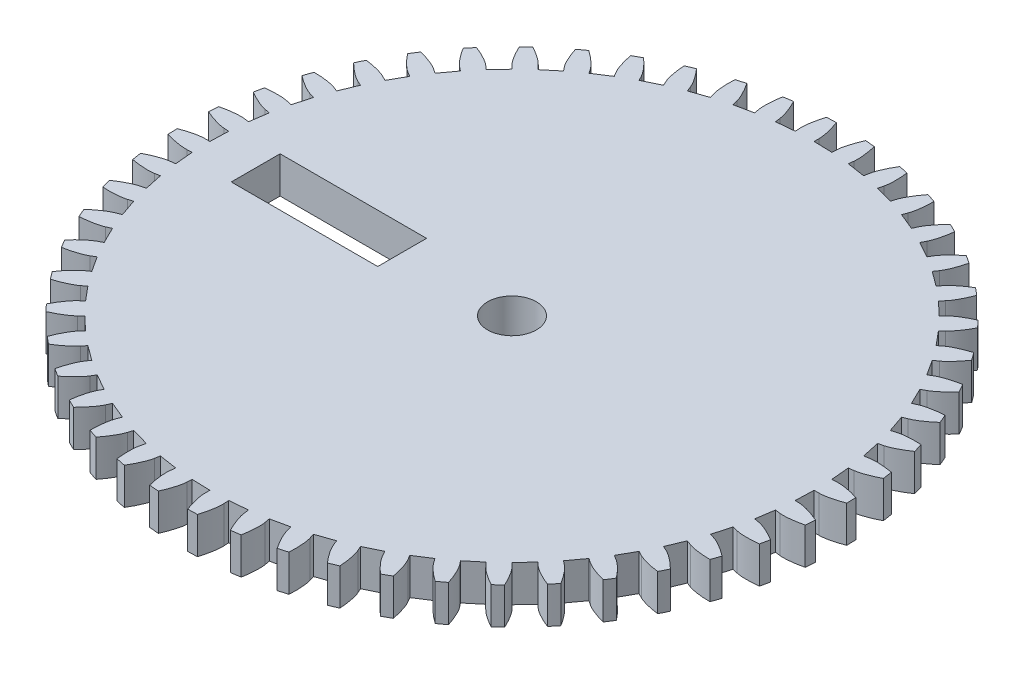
SolidWorks part; units mm, degrees
ref_plane "Front Plane" through (0, 0, 0) normal (0, 0, 1) x (1, 0, 0)
ref_plane "Top Plane" through (0, 0, 0) normal (0, 1, 0) x (1, 0, 0)
ref_plane "Right Plane" through (0, 0, 0) normal (1, 0, 0) x (0, 0, -1)
sketch "Sketch1" plane through (0, 0, 0) normal (0, 1, 0) x (1, 0, 0)
  line L0 (0, 0) -> (0, 12.5859) construction
  line L1 (0, 0) -> (-12.5859, 0) construction
  line L2 (0, 0) -> (-13.4938, -0.4077) construction
  line L3 (0, 0) -> (-12.563, -0.7599) construction
  line L4 (0, 0) -> (-12.4942, -1.5171) construction
  circle A0 centre (0, 0) radius 13 construction
  circle A1 centre (0, 0) radius 12.5859 construction
  circle A2 centre (0, 0) radius 12.375 construction
  circle A3 centre (0, 0) radius 13.5 construction
  spline S0 degree 4 poles (-12.5859, 0) (-12.608, 0) (-12.6699, -0.0023) (-12.7865, -0.0155) (-12.9748, -0.0498) (-13.2113, -0.1118) (-13.5113, -0.2128) (-13.8558, -0.3577) (-14.2233, -0.5437) (-14.6092, -0.7738) (-14.9806, -1.0273) (-15.3371, -1.3013) (-15.679, -1.5934) (-16.0761, -1.9675) (-16.5278, -2.4461) (-17.0173, -3.0416) (-17.5249, -3.7644) (-17.9874, -4.5362) (-18.3967, -5.3369) (-18.7094, -6.0595) (-18.9458, -6.6905) (-19.1221, -7.225) (-19.2509, -7.6538) (-19.3969, -8.2001) (-19.5226, -8.7411) (-19.6295, -9.303) (-19.7338, -9.9536) (-19.8032, -10.5394) (-19.8517, -11.0503) (-19.8907, -11.7697) (-19.9003, -12.1399) (-19.9051, -12.7168) (-19.8947, -12.9798) (-19.8902, -13.2128) (-19.8858, -13.2827) (-19.884, -13.3331) (-19.8831, -13.3603) knots 0 0 0 0 0 0.005377 0.015084 0.028532 0.04661 0.064855 0.092111 0.119476 0.146842 0.174209 0.201575 0.228941 0.256307 0.307035 0.361767 0.4165 0.471232 0.525964 0.580697 0.608063 0.635429 0.662795 0.690161 0.744894 0.77226 0.799626 0.854358 0.881725 0.909091 0.954545 0.977273 0.988636 0.994318 1 1 1 1 1 construction
  spline S1 degree 4 poles (-12.5859, 0) (-12.608, 0) (-12.6699, -0.0023) (-12.7865, -0.0155) (-12.9748, -0.0498) (-13.2113, -0.1118) (-13.5113, -0.2128) (-13.8558, -0.3577) (-14.2233, -0.5437) (-14.6092, -0.7738) (-14.9806, -1.0273) (-15.3371, -1.3013) (-15.679, -1.5934) (-16.0761, -1.9675) (-16.5278, -2.4461) (-17.0173, -3.0416) (-17.5249, -3.7644) (-17.9874, -4.5362) (-18.3967, -5.3369) (-18.7094, -6.0595) (-18.9458, -6.6905) (-19.1221, -7.225) (-19.2509, -7.6538) (-19.3969, -8.2001) (-19.5226, -8.7411) (-19.6295, -9.303) (-19.7338, -9.9536) (-19.8032, -10.5394) (-19.8517, -11.0503) (-19.8792, -11.5586) (-19.8878, -11.764) (-19.8912, -11.8661) knots 0 0 0 0 0 0.005377 0.015084 0.028532 0.04661 0.064855 0.092111 0.119476 0.146842 0.174209 0.201575 0.228941 0.256307 0.307035 0.361767 0.4165 0.471232 0.525964 0.580697 0.608063 0.635429 0.662795 0.690161 0.744894 0.77226 0.799626 0.854358 0.881725 0.909091 0.909091 0.909091 0.909091 0.909091
  dimension "D1" = 27
  dimension "D2" = 26
  dimension "D3" = 25.1718
  dimension "D4" = 24.75
  dimension "D5" = 12.5859
  dimension "D6" = 1.731
  dimension "D7" = 3.462
  dimension "D8" = 6.923
sketch "Sketch2" plane through (0, 0, 0) normal (0, 1, 0) x (1, 0, 0)
  line L0 (0, 0) -> (-13.4938, -0.4077) construction
  line L1 (0, 0) -> (-13.4938, -0.4077) construction
  line L2 (0, 0) -> (-12.563, -0.7599) construction
  line L3 (0, 0) -> (-12.5859, 0) construction
  line L4 (0, 0) -> (-12.4942, -1.5171) construction
  line L5 (0, 0) -> (-12.563, -0.7599) construction
  line L6 (0, 0) -> (-12.5859, 0) construction
  line L7 (0, 0) -> (-12.4942, -1.5171) construction
  line L8 (-12.563, -0.7599) -> (-12.3524, -0.7472)
  line L9 (-12.3524, -0.7472) -> (-12.2848, -1.4916)
  line L10 (-12.2848, -1.4916) -> (-12.4942, -1.5171) construction
  line L11 (-12.2848, -1.4916) -> (-0.9927, -0.1205)
  line L12 (-12.5859, 0) -> (-1, 0)
  circle A0 centre (0, 0) radius 12.375 construction
  circle A1 centre (0, 0) radius 12.5859 construction
  circle A2 centre (0, 0) radius 13 construction
  circle A3 centre (0, 0) radius 13.5 construction
  circle A4 centre (0, 0) radius 12.375 construction
  circle A5 centre (0, 0) radius 12.5859 construction
  circle A6 centre (0, 0) radius 13 construction
  circle A7 centre (0, 0) radius 13.5 construction
  arc A8 (-13.4866, -0.6019) -> (-13.4983, -0.2134) centre (0, 0) cw
  circle A11 centre (0, 0) radius 1 construction
  arc A12 (-1, 0) -> (-0.9927, -0.1205) centre (0, 0) ccw
  spline S0 degree 4 poles (-72.7187, -1998.9187) (-8.9087, -40.06) (-9.6085, -0.848) (-11.3659, 0.243) (-12.9748, -0.0498) (-13.2113, -0.1118) (-13.5113, -0.2128) (-13.8558, -0.3577) (-14.2233, -0.5437) (-14.6092, -0.7738) (-14.9806, -1.0273) (-15.3371, -1.3013) (-15.679, -1.5934) (-16.0761, -1.9675) (-16.5278, -2.4461) (-17.0173, -3.0416) (-17.5249, -3.7644) (-17.9874, -4.5362) (-18.3967, -5.3369) (-18.7094, -6.0595) (-18.9458, -6.6905) (-19.1221, -7.225) (-19.2509, -7.6538) (-19.3969, -8.2001) (-19.5226, -8.7411) (-19.6295, -9.303) (-19.7338, -9.9536) (-19.8032, -10.5394) (-20.0169, -12.7929) (-19.9107, -17.7061) (-17.4908, 39.3606) (-84.8048, -2010.7242) knots -0.351473 -0.351473 -0.351473 -0.351473 -0.351473 0.005377 0.015084 0.028532 0.04661 0.064855 0.092111 0.119476 0.146842 0.174209 0.201575 0.228941 0.256307 0.307035 0.361767 0.4165 0.471232 0.525964 0.580697 0.608063 0.635429 0.662795 0.690161 0.744894 0.77226 0.799626 0.854358 0.881725 1.375858 1.375858 1.375858 1.375858 1.375858 only from (-12.5859, 0) to (-19.8912, -11.8661) construction
  spline S1 degree 4 poles (-12.5859, 0) (-12.608, 0) (-12.6699, -0.0023) (-12.7865, -0.0155) (-12.9748, -0.0498) (-13.1813, -0.104) (-13.3462, -0.1576) (-13.4572, -0.1979) (-13.4983, -0.2134) knots 0 0 0 0 0 0.005377 0.015084 0.028532 0.04661 0.057303 0.057303 0.057303 0.057303 0.057303
  spline S2 degree 4 poles (-12.563, -0.7599) (-12.585, -0.7613) (-12.6469, -0.7627) (-12.7641, -0.7565) (-12.9542, -0.7337) (-13.1635, -0.6921) (-13.3314, -0.6485) (-13.4446, -0.615) (-13.4866, -0.6019) knots 0 0 0 0 0 0.005377 0.015084 0.028532 0.04661 0.057303 0.057303 0.057303 0.057303 0.057303
  point P21 (-12.3524, -0.7472)
  point P24 (-12.2848, -1.4916)
  dimension "D2" = 2
extrude "Boss-Extrude1" add sketch "Sketch2" along normal blind 1.5
pattern_circular "CirPattern1" count 52 over 360 of "Boss-Extrude1"
sketch "Sketch3" plane through (0, 1.5, 0) normal (0, 1, 0) x (1, 0, 0)
  line L1 (-10.5, -1) -> (-4.5, -1)
  line L2 (-10.5, -1) -> (-10.5, 1)
  line L3 (-10.5, 1) -> (-4.5, 1)
  line L4 (-4.5, -1) -> (-4.5, 1)
  line L5 (-10.5, -1) -> (-4.5, 1) construction
  line L6 (-10.5, 1) -> (-4.5, -1) construction
  point P0 (-7.5, 0)
  point P5 (-4.5, 0)
  point P6 (0, 0)
  dimension "D1" = 2
  dimension "D2" = 6
  dimension "D3" = 4.5
extrude "Cut-Extrude1" cut sketch "Sketch3" against normal up to surface (1.5 mm away)
equation "\"Module\"= .5"
equation "\"Number of Teeth\"= 52"
equation "\"Pressure Angle\"= 14.5deg"
equation "\"Pitch Diameter\"= \"Number of Teeth\" * \"Module\""
equation "\"Circular Pitch\"= pi * \"Module\""
equation "\"Addendum\"= \"Module\""
equation "\"Dedendum\"= 1.25 * \"Module\""
equation "\"Base Diameter\"= \"Pitch Diameter\" * cos ( \"Pressure Angle\" )"
equation "\"Base Radius\"= \"Base Diameter\" / 2"
equation "\"Width\"= 1.5"
equation "\"Outside Diameter\"= \"Pitch Diameter\" + 2 * \"Addendum\""
equation "\"D1@Sketch1\"=\"Outside Diameter\""
equation "\"D3@Sketch1\"=\"Base Diameter\""
equation "\"Root Diameter\"= \"Pitch Diameter\" - 2 * \"Dedendum\""
equation "\"D4@Sketch1\"=\"Root Diameter\""
equation "\"Tooth Angle\"= 360 / \"Number of Teeth\""
equation "\"D6@Sketch1\"=\"Tooth Angle\"/4"
equation "\"D7@Sketch1\"=\"Tooth Angle\"/2"
equation "\"D8@Sketch1\"=\"Tooth Angle\""
equation "\"D2@Sketch1\" = \"Pitch Diameter\""
equation "\"Shaft Diameter\" = 2"
equation "\"D1@CirPattern1\" = \"Number of Teeth\""
equation "\"D2@Sketch2\"= \"Shaft Diameter\""
equation "\"D1@Boss-Extrude1\" = \"Width\""
